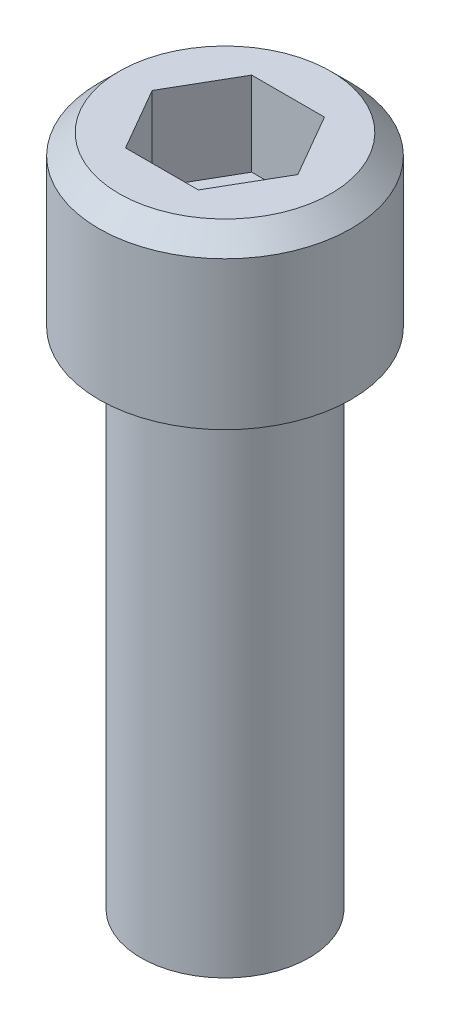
SolidWorks part; units mm, degrees
ref_plane "Plane1" through (0, 0, 0) normal (0, 0, 1) x (1, 0, 0)
ref_plane "Plane2" through (0, 0, 0) normal (0, 1, 0) x (1, 0, 0)
ref_plane "Plane3" through (0, 0, 0) normal (1, 0, 0) x (0, 0, -1)
sketch "Sketch1" plane through (0, 0, 0) normal (0, 0, 1) x (1, 0, 0)
  line L0 (0, 0) -> (0, 43.6223) construction
  line L1 (6.35, 0) -> (9.525, 0)
  line L2 (9.525, 0) -> (9.525, 12.7)
  line L3 (9.525, 12.7) -> (0, 12.7)
  line L4 (0, 12.7) -> (0, -38.1)
  line L5 (0, -38.1) -> (6.35, -38.1)
  line L6 (6.35, -38.1) -> (6.35, 0)
  line L7 (50, 0) -> (-50, 0) construction
  dimension "D1" = 19.05
  dimension "D2" = 12.7
  dimension "D3" = 12.7
  dimension "D4" = 38.1
revolve "Base-Revolve" add sketch "Sketch1" angle 360 about L0
sketch "Sketch2" plane through (0, 12.7, 0) normal (0, 1, 0) x (-1, 0, 0)
  line L0 (2.7496, -4.7625) -> (-2.7496, -4.7625)
  line L1 (-5.4993, 0) -> (-2.7496, -4.7625)
  line L2 (0, 0) -> (0, -4.7625) construction
  line L3 (0, 0) -> (-5.4993, 0) construction
  line L4 (5.4993, 0) -> (2.7496, -4.7625)
  line L5 (5.4993, 0) -> (2.7496, 4.7625)
  line L6 (-5.4993, 0) -> (-2.7496, 4.7625)
  line L7 (2.7496, 4.7625) -> (-2.7496, 4.7625)
  circle A0 centre (0, 0) radius 4.7625 construction
  point P12 (0, -4.7625)
  point P14 (0, 4.7625)
  dimension "D2" = 9.525
extrude "Cut-Extrude1" cut sketch "Sketch2" against normal blind 6.35
chamfer "Chamfer1" distance 1.524 angle 45 1 edges at (0, 12.7, -9.525)
chamfer "Chamfer2" [suppressed] distance 0.762 angle 45
